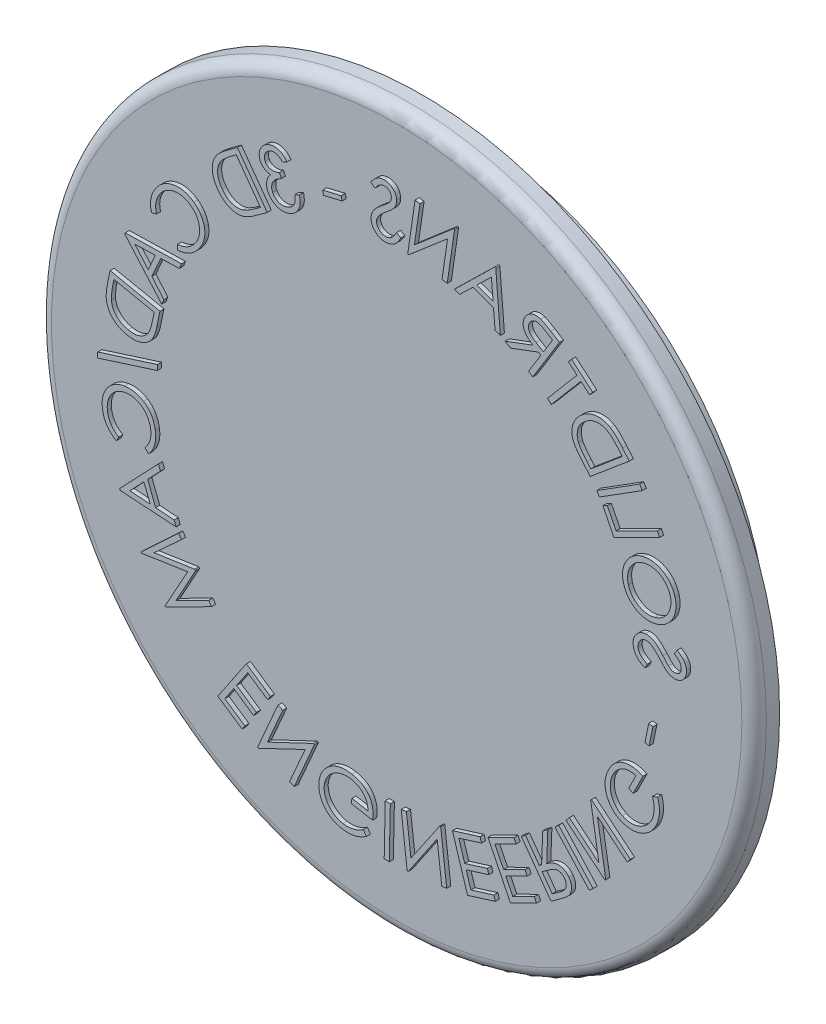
SolidWorks part; units mm, degrees
ref_plane "Front" through (0, 0, 0) normal (0, 0, 1) x (1, 0, 0)
ref_plane "Top" through (0, 0, 0) normal (0, 1, 0) x (1, 0, 0)
ref_plane "Right" through (0, 0, 0) normal (1, 0, 0) x (0, 0, -1)
mirrored part "Label_Mirrored"
other "<Label>-<Extrude3>"
